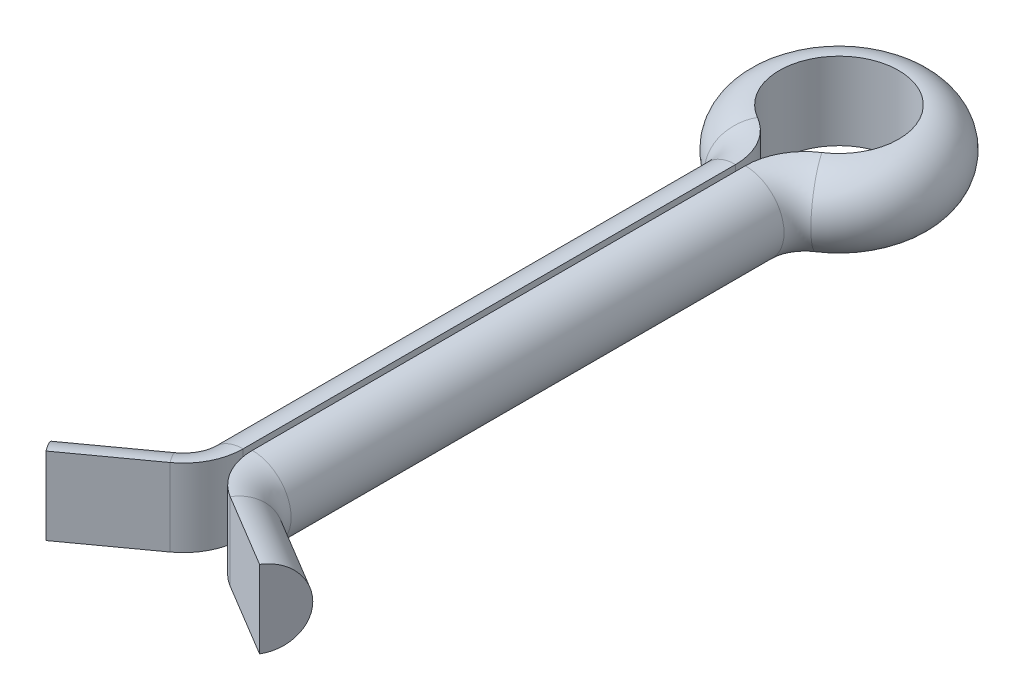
SolidWorks part; units mm, degrees
ref_plane "Face" through (0, 0, 0) normal (0, 0, 1) x (1, 0, 0)
ref_plane "Dessus" through (0, 0, 0) normal (0, 1, 0) x (1, 0, 0)
ref_plane "Droite" through (0, 0, 0) normal (1, 0, 0) x (0, 0, -1)
sketch "Esquisse2" plane through (0, 0, 0) normal (0, 1, 0) x (1, 0, 0)
  line L0 (0, 1.0218) -> (0, 17.5359)
  line L1 (-0.828, -0.5988) -> (-3.2412, -2.344)
  line L2 (0.2, 17.6593) -> (0.2, 1.1332)
  line L3 (1.1721, -0.5824) -> (3.6313, -2.0557)
  arc A0 (1.1, 19.3297) -> (-1, 19.2679) centre (0, 21) ccw
  arc A1 (1.1721, -0.5824) -> (0.2, 1.1332) centre (2.2, 1.1332) cw
  arc A2 (-0.828, -0.5988) -> (0, 1.0218) centre (-2, 1.0218) ccw
  arc A3 (0, 17.5359) -> (-1, 19.2679) centre (-2, 17.5359) ccw
  arc A4 (0.2, 17.6593) -> (1.1, 19.3297) centre (2.2, 17.6593) cw
  point P10 (0.2, 0)
  point P13 (0, 0)
  point P16 (0, 19)
  dimension "D1" = 4
  dimension "D6" = 2
  dimension "D7" = 2
  dimension "D8" = 2
  dimension "D9" = 2
  dimension "D2" = 19
  dimension "D3" = 4
  dimension "D4" = 0.2
  dimension "D5" = 4
ref_plane "Plan1" through (3.6313, 0, 2.0557) normal (0.8578, 0, 0.5139) x (0.5139, 0, -0.8578)
sketch "Esquisse3" plane through (3.6313, 0, 2.0557) normal (0.8578, 0, 0.5139) x (0.5139, 0, -0.8578)
  line L0 (0, 1.3) -> (0, -1.3)
  arc A0 (0, -1.3) -> (0, 1.3) centre (0, 0) ccw
  dimension "D1" = 1.3
sweep "Balayage3" add profiles "Esquisse3" path "Esquisse2"
